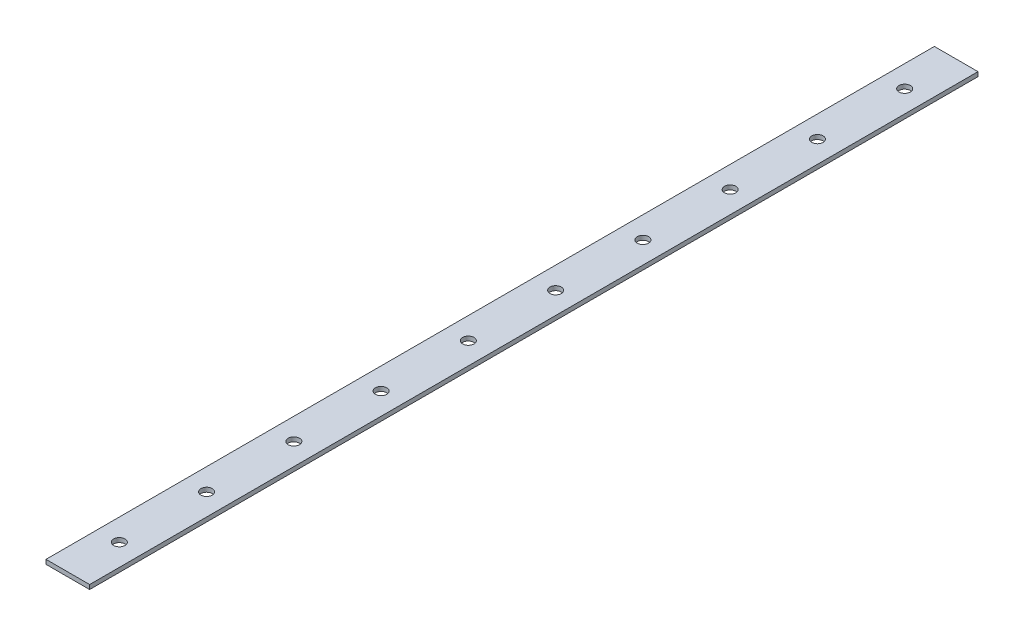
SolidWorks part; units mm, degrees
ref_plane "Plan de face" through (0, 0, 0) normal (0, 0, 1) x (1, 0, 0)
ref_plane "Plan de dessus" through (0, 0, 0) normal (0, 1, 0) x (1, 0, 0)
ref_plane "Plan de droite" through (0, 0, 0) normal (1, 0, 0) x (0, 0, -1)
sketch "Esquisse1" plane through (0, 0, 0) normal (0, 0, 1) x (1, 0, 0)
  line L1 (-25, 2.5) -> (25, 2.5)
  line L2 (-25, 2.5) -> (-25, -2.5)
  line L3 (-25, -2.5) -> (25, -2.5)
  line L4 (25, 2.5) -> (25, -2.5)
  dimension "D1" = 50
  dimension "D2" = 25
  dimension "D3" = 5
  dimension "D4" = 2.5
extrude "Extrusion1" add sketch "Esquisse1" along normal mid plane 1018
sketch "Esquisse2" plane through (0, 2.5, 0) normal (0, 1, 0) x (-1, 0, 0)
  line L0 (-25, -509) -> (25, -509) construction
  line L1 (-25, 509) -> (-25, -509) construction
  line L2 (25, 509) -> (-25, 509) construction
  circle A0 centre (0, -450) radius 6.5
  circle A1 centre (0, -350) radius 6.5
  circle A2 centre (0, -250) radius 6.5
  circle A3 centre (0, -150) radius 6.5
  circle A4 centre (0, -50) radius 6.5
  circle A5 centre (0, 50) radius 6.5
  circle A6 centre (0, 150) radius 6.5
  circle A7 centre (0, 250) radius 6.5
  circle A8 centre (0, 350) radius 6.5
  circle A9 centre (0, 450) radius 6.5
  dimension "D1" = 13
  dimension "D2" = 59
  dimension "D3" = 25
extrude "Enlèv. mat.-Extru.1" cut sketch "Esquisse2" against normal through all
